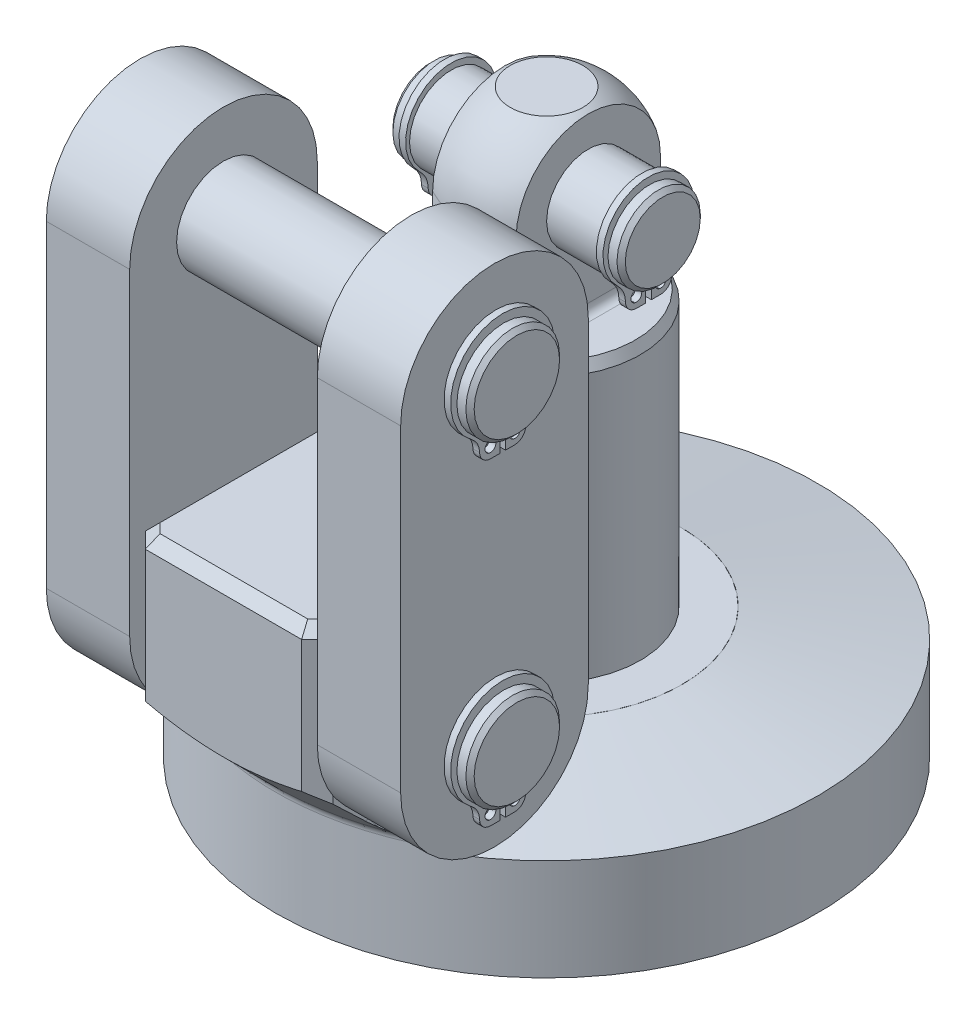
SolidWorks part; units mm, degrees
ref_plane "Front Plane" through (0, 0, 0) normal (0, 0, 1) x (1, 0, 0)
ref_plane "Top Plane" through (0, 0, 0) normal (0, 1, 0) x (1, 0, 0)
ref_plane "Right Plane" through (0, 0, 0) normal (1, 0, 0) x (0, 0, -1)
sketch "Sketch1" plane through (0, 0, 0) normal (0, 1, 0) x (1, 0, 0)
  line L0 (-9, 0) -> (9, 0)
  line L1 (9, 0) -> (9, -31)
  line L2 (9, -31) -> (-9, -31)
  line L3 (-9, -31) -> (-9, 0)
  line L4 (0, 1.05) -> (0, -22.05) construction
  dimension "D1" = 18
  dimension "D2" = 31
extrude "Extrude1" add sketch "Sketch1" along normal blind 30
sketch "S2D0003" plane through (0, 0, 0) normal (1, 0, 0) x (0, 0, -1)
  line L0 (0, 0) -> (0, 12.5)
  line L1 (-31, 0) -> (0, 0)
  line L2 (-31, 0) -> (-31, 8.674)
  line L3 (0, 12.5) -> (-13, 12.5)
  line L4 (-13, 12.5) -> (-31, 8.674)
  line L5 (0, 9.45) -> (0, -2.5987) construction
  line L6 (0, 30) -> (0, 0) construction
  line L8 (-31, 0) -> (0, 0) construction
  line L10 (-31, 30) -> (-31, 0) construction
  dimension "D1" = 12.5
  dimension "D2" = 12
  dimension "D3" = 26
sketch "S2D0004" plane through (0, 0, 0) normal (1, 0, 0) x (0, 0, -1)
  line L0 (-36, 20.4742) -> (-26.2929, 10.7671)
  line L1 (-26, 10.06) -> (-26, 0)
  line L2 (0, 16.6313) -> (0, -1.1122) construction
  line L3 (0, 30) -> (0, 0) construction
  line L5 (-31, 0) -> (0, 0) construction
  line L6 (-36, 20.4742) -> (-36, 0)
  line L7 (-36, 0) -> (-26, 0)
  line L8 (-31, 30) -> (-31, 0) construction
  arc A0 (-26, 10.06) -> (-26.2929, 10.7671) centre (-27, 10.06) ccw
  dimension "D4" = 1
  dimension "D1" = 52
  dimension "D2" = 10.06
  dimension "D3" = 45
  dimension "D5" = 5
sketch "Sketch4" plane through (0, 0, 0) normal (1, 0, 0) x (0, 0, -1)
  line L0 (0, 12.5) -> (13, 12.5)
  line L1 (13, 12.5) -> (13, 30)
  line L2 (13, 30) -> (0, 30)
  line L3 (0, 30) -> (0, 12.5)
  line L4 (0, 21.6) -> (0, 8.4) construction
  line L5 (0, 30) -> (0, 0) construction
  line L6 (-31, 30) -> (0, 30) construction
  dimension "D1" = 26
  dimension "D2" = 17.5
revolve "Cut-Revolve5" cut sketch "Sketch4" angle 360 about L4
revolve "Revolve1" add sketch "S2D0003" angle 360 about L5
revolve "Cut-Revolve4" cut sketch "S2D0004" angle 360 about L2
sketch "Sketch7" plane through (9, 0, 0) normal (1, 0, 0) x (0, 0, -1)
  line L0 (-26, 0) -> (26, 0) construction
  circle A0 centre (-22, 21) radius 4.5
  dimension "D1" = 9
  dimension "D2" = 21
  dimension "D3" = 22
extrude "Cut-Extrude3" cut sketch "Sketch7" against normal through all
fillet "Fillet1" radius 1.5 2 edges at (-9, 21.25, 9.3808) (9, 21.25, 9.3808)
fillet "Fillet2" radius 3.18 5 edges at (-8.273, 12.3165, 11.1242) (0, 12.5, 13) (8.1467, 12.3441, 11.0562)
chamfer "Chamfer1" distance 1.5 angle 45 2 edges at (-9, 23.3771, 31) (9, 23.3771, 31)
chamfer "Chamfer2" distance 1 angle 45 8 edges at (-9, 30, 20.9548) (-8.237, 30, 11.1032) (0, 30, 13) (8.237, 30, 11.1032) (-8.25, 30, 30.25) (9, 30, 20.9548) (8.25, 30, 30.25) (0, 30, 31)
ref_plane "Plane1" through (0, 0, 22) normal (0, 0, 1) x (1, 0, 0)
sketch "Sketch8" plane through (0, 0, 22) normal (0, 0, 1) x (1, 0, 0)
  line L0 (9, 21) -> (9, 11.5)
  line L1 (10.14, 10.36) -> (19.64, 10.36)
  line L2 (19.64, 10.36) -> (19.64, 21)
  line L3 (19.64, 21) -> (9, 21)
  line L4 (5.637, 21) -> (19.4125, 21) construction
  line L5 (-9, 21) -> (9, 21) construction
  line L6 (9, 30) -> (9, 16.7542) construction
  line L7 (0, 0) -> (0, 26.6501) construction
  line L8 (-19.64, 21) -> (-9, 21)
  line L9 (-19.64, 10.36) -> (-19.64, 21)
  line L10 (-10.14, 10.36) -> (-19.64, 10.36)
  line L11 (-9, 21) -> (-9, 11.5)
  arc A0 (9, 11.5) -> (10.14, 10.36) centre (10.14, 11.5) ccw
  arc A1 (-9, 11.5) -> (-10.14, 10.36) centre (-10.14, 11.5) cw
  dimension "D4" = 1.14
  dimension "D2" = 21.28
  dimension "D3" = 10.64
revolve "Cut-Revolve6" cut sketch "Sketch8" angle 360 about L4
sketch "Sketch10" plane through (0, 0, 0) normal (1, 0, 0) x (0, 0, -1)
  line L0 (0, 12.5) -> (0, 55.7)
  line L1 (0, 55.7) -> (3.4871, 55.7)
  line L2 (8, 48.5) -> (8, 40.0445)
  line L3 (8, 40.0445) -> (9, 37.9)
  line L4 (9, 37.9) -> (9, 12.5)
  line L5 (9, 12.5) -> (0, 12.5)
  line L6 (0, 44.745) -> (0, 7.55) construction
  line L7 (22.759, -16.5) -> (-24.5324, -16.5) construction
  line L9 (13, 12.5) -> (-8.3605, 12.5) construction
  arc A0 (8, 48.5) -> (3.4871, 55.7) centre (0, 48.5) ccw
  circle A1 centre (0, 48.5) radius 4 construction
  dimension "D2" = 8
  dimension "D3" = 8
  dimension "D5" = 65
  dimension "D1" = 7.2
  dimension "D4" = 29
  dimension "D6" = 18
  dimension "D7" = 16
  dimension "D8" = 25
  dimension "D9" = 17.8
revolve "Revolve2" add sketch "Sketch10" angle 360 about L6
sketch "Sketch12" plane through (0, 0, 0) normal (0, 0, 1) x (1, 0, 0)
  line L0 (4, 55.7) -> (9, 55.7)
  line L1 (9, 55.7) -> (9, 38.9)
  line L2 (9, 38.9) -> (4.8, 38.9)
  line L3 (4, 39.7) -> (4, 55.7)
  line L4 (3.4871, 55.7) -> (-3.4871, 55.7) construction
  line L5 (9, 12.5) -> (9, 37.9) construction
  line L6 (-4, 39.7) -> (-4, 55.7)
  line L7 (-9, 38.9) -> (-4.8, 38.9)
  line L8 (0, 38.525) -> (0, 26.975) construction
  line L9 (-9, 55.7) -> (-9, 38.9)
  line L10 (-4, 55.7) -> (-9, 55.7)
  arc A0 (4, 39.7) -> (4.8, 38.9) centre (4.8, 39.7) ccw
  arc A1 (-4, 39.7) -> (-4.8, 38.9) centre (-4.8, 39.7) cw
  dimension "D3" = 0.8
  dimension "D1" = 8
  dimension "D2" = 16.8
extrude "Cut-Extrude5" cut sketch "Sketch12" against normal mid plane 16
sketch "Sketch14" plane through (4, 0, 0) normal (1, 0, 0) x (0, 0, -1)
  line L0 (3.4871, 55.7) -> (-3.4871, 55.7) construction
  circle A0 centre (0, 48.5) radius 4
  dimension "D2" = 8
  dimension "D1" = 7.2
extrude "Cut-Extrude7" cut sketch "Sketch14" against normal up to next
sketch "S2D0005" plane through (9, 0, 0) normal (1, 0, 0) x (0, 0, -1)
  line L0 (-31, 51.5) -> (-31, 21)
  line L1 (-13, 51.5) -> (-13, 21)
  line L2 (-22, 51.5) -> (-22, 21) construction
  line L3 (0, 48.5) -> (0, 51.5) construction
  line L4 (0, 51.5) -> (-22, 51.5) construction
  arc A0 (-13, 51.5) -> (-31, 51.5) centre (-22, 51.5) ccw
  arc A1 (-31, 21) -> (-13, 21) centre (-22, 21) ccw
  circle A2 centre (-22, 51.5) radius 4.5
  circle A3 centre (-22, 21) radius 4.5
  circle A6 centre (-22, 21) radius 4.5 construction
  dimension "D2" = 30.5
  dimension "D1" = 18
  dimension "D3" = 22
  dimension "D4" = 3
extrude "Extrude2" add sketch "S2D0005" along normal blind 8
sketch "S2D0006" plane through (0, 0, 0) normal (0, 0, 1) x (1, 0, 0)
  line L0 (-9.15, 52.5) -> (9.15, 52.5)
  line L1 (11.15, 52.1) -> (11.15, 48.5)
  line L2 (10.75, 52.5) -> (11.15, 52.1)
  line L3 (9.89, 52.5) -> (10.75, 52.5)
  line L4 (9.89, 52.185) -> (9.89, 52.5)
  line L5 (9.15, 52.185) -> (9.89, 52.185)
  line L6 (9.15, 52.5) -> (9.15, 52.185)
  line L7 (11.15, 48.5) -> (-11.15, 48.5)
  line L8 (-9.15, 52.5) -> (-9.15, 52.185)
  line L9 (-9.15, 52.185) -> (-9.89, 52.185)
  line L10 (-9.89, 52.185) -> (-9.89, 52.5)
  line L11 (-9.89, 52.5) -> (-10.75, 52.5)
  line L12 (-10.75, 52.5) -> (-11.15, 52.1)
  line L13 (-11.15, 52.1) -> (-11.15, 48.5)
  line L14 (-8.415, 48.5) -> (8.415, 48.5) construction
  line L15 (-4, 48.5) -> (4, 48.5) construction
  line L16 (0, 40.8686) -> (0, 24.9357) construction
  line L17 (0, 40.0445) -> (0, 48.5) construction
  line L18 (4, 52.5) -> (-4, 52.5) construction
  dimension "D1" = 22.3
  dimension "D3" = 0.74
  dimension "D4" = 7.37
  dimension "D5" = 18.3
  dimension "D6" = 0.4
  dimension "D7" = 45
revolve "Revolve3" add sketch "S2D0006" angle 360 about L14
ref_plane "Plane2" through (0, 0, 22) normal (0, 0, 1) x (1, 0, 0)
sketch "Sketch18" plane through (0, 0, 22) normal (0, 0, 1) x (1, 0, 0)
  line L0 (-17.15, 25.5) -> (17.15, 25.5)
  line L1 (19.15, 25.1) -> (19.15, 21)
  line L2 (18.75, 25.5) -> (19.15, 25.1)
  line L3 (17.89, 25.5) -> (18.75, 25.5)
  line L4 (17.89, 25.19) -> (17.89, 25.5)
  line L5 (17.15, 25.19) -> (17.89, 25.19)
  line L6 (17.15, 25.5) -> (17.15, 25.19)
  line L7 (-17.15, 25.5) -> (-17.15, 25.19)
  line L8 (-17.15, 25.19) -> (-17.89, 25.19)
  line L9 (-17.89, 25.19) -> (-17.89, 25.5)
  line L10 (-17.89, 25.5) -> (-18.75, 25.5)
  line L11 (-18.75, 25.5) -> (-19.15, 25.1)
  line L12 (-19.15, 25.1) -> (-19.15, 21)
  line L13 (-13.915, 21) -> (13.915, 21) construction
  line L14 (-9, 21) -> (17, 21) construction
  line L15 (0, 28.7058) -> (0, -18.8155) construction
  line L16 (-19.15, 21) -> (19.15, 21)
  line L17 (17, 25.5) -> (-9, 25.5) construction
  dimension "D2" = 38.3
  dimension "D3" = 8.38
  dimension "D4" = 0.74
  dimension "D5" = 34.3
  dimension "D6" = 0.4
  dimension "D7" = 45
revolve "Revolve4" add sketch "Sketch18" angle 360 about L13
sketch "Sketch20" plane through (9.15, 0, 0) normal (1, 0, 0) x (0, 0, -1)
  line L0 (0.2762, 42.7322) -> (1.169, 42.7322)
  line L1 (0.2762, 44.9422) -> (0.2762, 42.7322)
  line L2 (-0.2763, 44.9422) -> (-0.2763, 42.7322)
  line L3 (-0.2763, 42.7322) -> (-1.169, 42.7322)
  line L4 (0, 30.527) -> (0, 23.2449) construction
  arc A0 (0.2762, 44.9422) -> (-0.2763, 44.9422) centre (0, 48.5) ccw
  arc A1 (2.9608, 45.4816) -> (-2.9608, 45.4816) centre (0, 48.7066) ccw
  circle A2 centre (0, 48.5) radius 4 construction
  circle A3 centre (1.169, 43.7732) radius 0.5205
  arc A4 (2.21, 43.7732) -> (1.169, 42.7322) centre (1.169, 43.7732) cw
  arc A5 (-2.21, 43.7732) -> (-2.9608, 45.4816) centre (-4.5292, 43.7732) ccw
  arc A6 (-2.21, 43.7732) -> (-1.169, 42.7322) centre (-1.169, 43.7732) ccw
  circle A7 centre (-1.169, 43.7732) radius 0.5205
  arc A8 (2.21, 43.7732) -> (2.9608, 45.4816) centre (4.5292, 43.7732) cw
  dimension "D1" = 0.5525
  dimension "D2" = 3.5685
  dimension "D3" = 4.3779
  dimension "D4" = 0.2066
  dimension "D6" = 1.041
  dimension "D9" = 1.041
  dimension "D10" = 2.3192
  dimension "D7" = 2.338
  dimension "D8" = 4.7268
extrude "Extrude4" add sketch "Sketch20" along normal blind 0.635
sketch "Sketch21" plane through (17.15, 0, 0) normal (1, 0, 0) x (0, 0, -1)
  line L0 (-21.7237, 14.7354) -> (-20.831, 14.7354)
  line L1 (-21.7238, 16.9454) -> (-21.7237, 14.7354)
  line L2 (-22.2762, 16.9454) -> (-22.2762, 14.7354)
  line L3 (-22.2762, 14.7354) -> (-23.169, 14.7354)
  line L4 (-22, 6.7838) -> (-22, 0.3066) construction
  line L5 (-31, 51.5) -> (-31, 21) construction
  arc A0 (-21.7238, 16.9454) -> (-22.2762, 16.9454) centre (-22, 21) ccw
  arc A1 (-19.064, 17.2018) -> (-24.936, 17.2018) centre (-22, 21.2396) ccw
  circle A2 centre (-20.831, 15.7764) radius 0.5205
  arc A3 (-19.79, 15.7764) -> (-20.831, 14.7354) centre (-20.831, 15.7764) cw
  arc A4 (-19.79, 15.7764) -> (-19.064, 17.2018) centre (-18.0276, 15.7764) cw
  arc A5 (-24.21, 15.7764) -> (-24.936, 17.2018) centre (-25.9724, 15.7764) ccw
  arc A6 (-24.21, 15.7764) -> (-23.169, 14.7354) centre (-23.169, 15.7764) ccw
  circle A7 centre (-23.169, 15.7764) radius 0.5205
  circle A8 centre (-22, 21) radius 4.5 construction
  dimension "D1" = 4.064
  dimension "D2" = 4.9924
  dimension "D3" = 0.2396
  dimension "D7" = 1.041
  dimension "D8" = 1.041
  dimension "D9" = 5.2236
  dimension "D10" = 1.7624
  dimension "D4" = 0.5525
  dimension "D6" = 2.338
extrude "Extrude5" add sketch "Sketch21" along normal blind 0.635
pattern_linear "LPattern1" count 2 spacing 30.5 along (0, 1, 0) of "Extrude5", "Revolve4"
mirror "Mirror1" about plane through (0, 0, 0) normal (1, 0, 0) of "Extrude5", "LPattern1", "Extrude4", "Extrude2"
